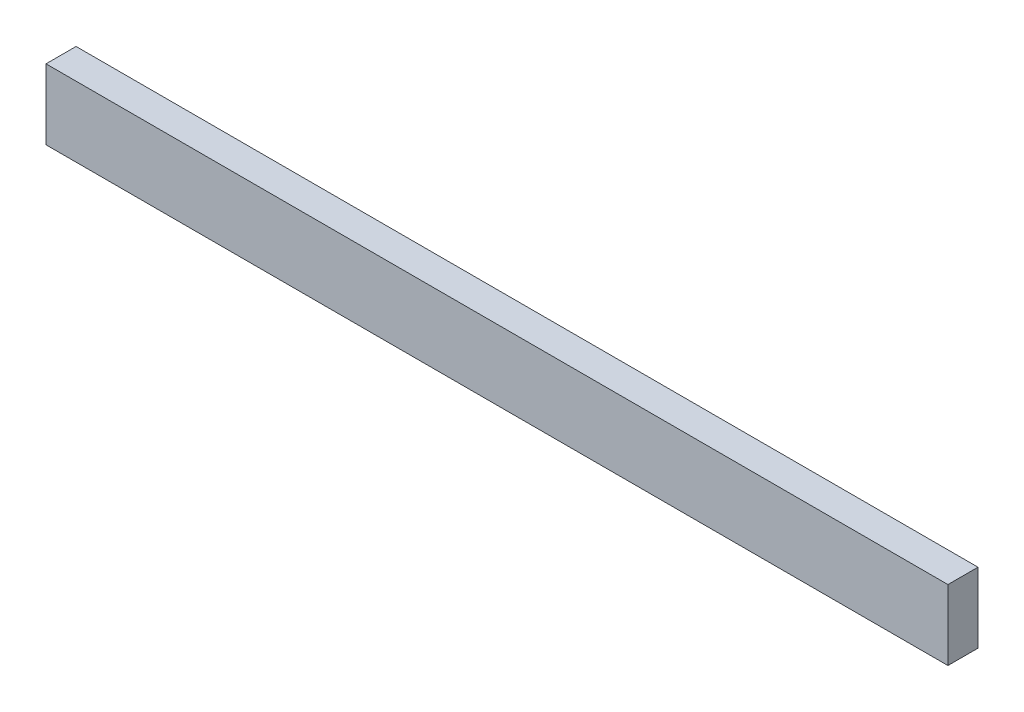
SolidWorks part; units mm, degrees
ref_plane "Front Plane" through (0, 0, 0) normal (0, 0, 1) x (1, 0, 0)
ref_plane "Top Plane" through (0, 0, 0) normal (0, 1, 0) x (1, 0, 0)
ref_plane "Right Plane" through (0, 0, 0) normal (1, 0, 0) x (0, 0, -1)
sketch "Sketch1" plane through (0, 0, 0) normal (1, 0, 0) x (0, 0, -1)
  line L1 (-19.05, -44.45) -> (19.05, -44.45)
  line L2 (-19.05, -44.45) -> (-19.05, 44.45)
  line L3 (-19.05, 44.45) -> (19.05, 44.45)
  line L4 (19.05, -44.45) -> (19.05, 44.45)
  line L5 (-19.05, -44.45) -> (19.05, 44.45) construction
  line L6 (-19.05, 44.45) -> (19.05, -44.45) construction
  point P0 (0, 0)
  dimension "D1" = 88.9
  dimension "D2" = 38.1
extrude "Boss-Extrude1" add sketch "Sketch1" along normal blind 1143
